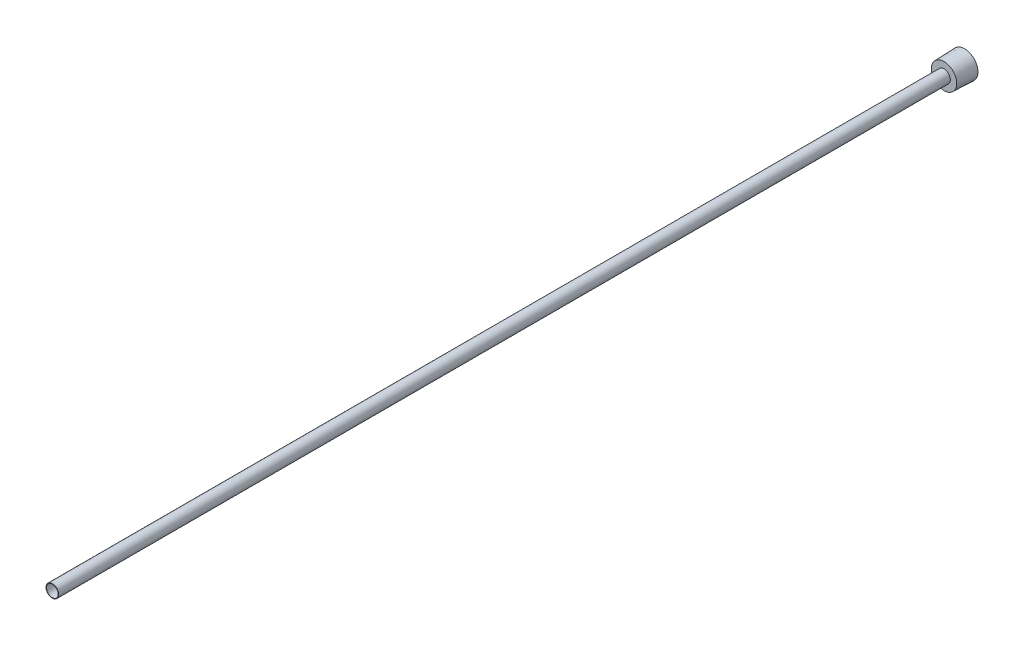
SolidWorks part; units mm, degrees
ref_plane "Front Plane" through (0, 0, 0) normal (0, 0, 1) x (1, 0, 0)
ref_plane "Top Plane" through (0, 0, 0) normal (0, 1, 0) x (1, 0, 0)
ref_plane "Right Plane" through (0, 0, 0) normal (1, 0, 0) x (0, 0, -1)
sketch "Sketch1" plane through (0, 0, 0) normal (1, 0, 0) x (0, 0, -1)
  line L0 (-331.1242, 0) -> (49668.8758, 0) construction
  line L1 (0, 0) -> (-457.2, 0)
  line L6 (0, 0) -> (0, 6.7183)
  line L7 (0, 6.7183) -> (-10.3124, 6.3421)
  line L8 (-10.3124, 3.175) -> (-457.2, 3.175)
  line L9 (-10.3124, 6.3421) -> (-10.3124, 3.175)
  line L10 (-457.2, 3.175) -> (-457.2, 0)
  dimension "D1" = 6.35
  dimension "D2" = 10.3124
  dimension "D3" = 2.089
  dimension "D4" = 13.4366
  dimension "D5" = 457.2
revolve "Revolve1" add sketch "Sketch1" angle 360 about L0
sketch "Sketch2" plane through (0, 0, 457.2) normal (0, 0, 1) x (1, 0, 0)
  circle A0 centre (0, 0) radius 2.921
  dimension "D1" = 5.842
extrude "Cut-Extrude1" cut sketch "Sketch2" against normal through all
sketch "Sketch3" plane through (0, 0, 0) normal (0, 0, -1) x (-1, 0, 0)
  line L0 (0, 7.3901) -> (0, -7.3901) construction
  line L1 (-3.175, -1.8331) -> (0, -3.6662)
  line L2 (0, -3.6662) -> (3.175, -1.8331)
  line L3 (3.175, -1.8331) -> (3.175, 1.8331)
  line L4 (3.175, 1.8331) -> (0, 3.6662)
  line L5 (0, 3.6662) -> (-3.175, 1.8331)
  line L6 (-3.175, 1.8331) -> (-3.175, -1.8331)
  circle A0 centre (0, 0) radius 3.175 construction
  dimension "D1" = 6.35
extrude "Cut-Extrude2" cut sketch "Sketch3" against normal blind 6.35
